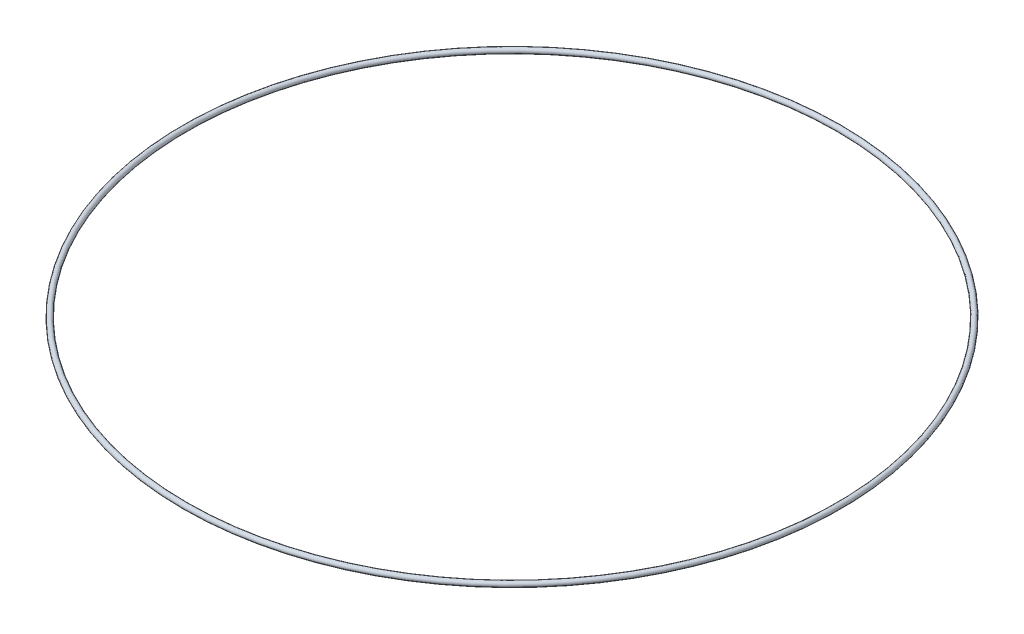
SolidWorks part; units mm, degrees
ref_plane "Front" through (0, 0, 0) normal (0, 0, 1) x (1, 0, 0)
ref_plane "Top" through (0, 0, 0) normal (0, 1, 0) x (1, 0, 0)
ref_plane "Right" through (0, 0, 0) normal (1, 0, 0) x (0, 0, -1)
sketch "Sketch1" plane through (0, 0, 0) normal (0, 0, 1) x (1, 0, 0)
  line L0 (0, 96.52) -> (0, -73.66) construction
  line L1 (0, 0) -> (-224.3753, 0) construction
  circle A0 centre (-295.275, 0) radius 2.3813
  dimension "D1" = 4.7625
  dimension "D2" = 590.55
revolve "Revolve1" add sketch "Sketch1" angle 360 about L0
